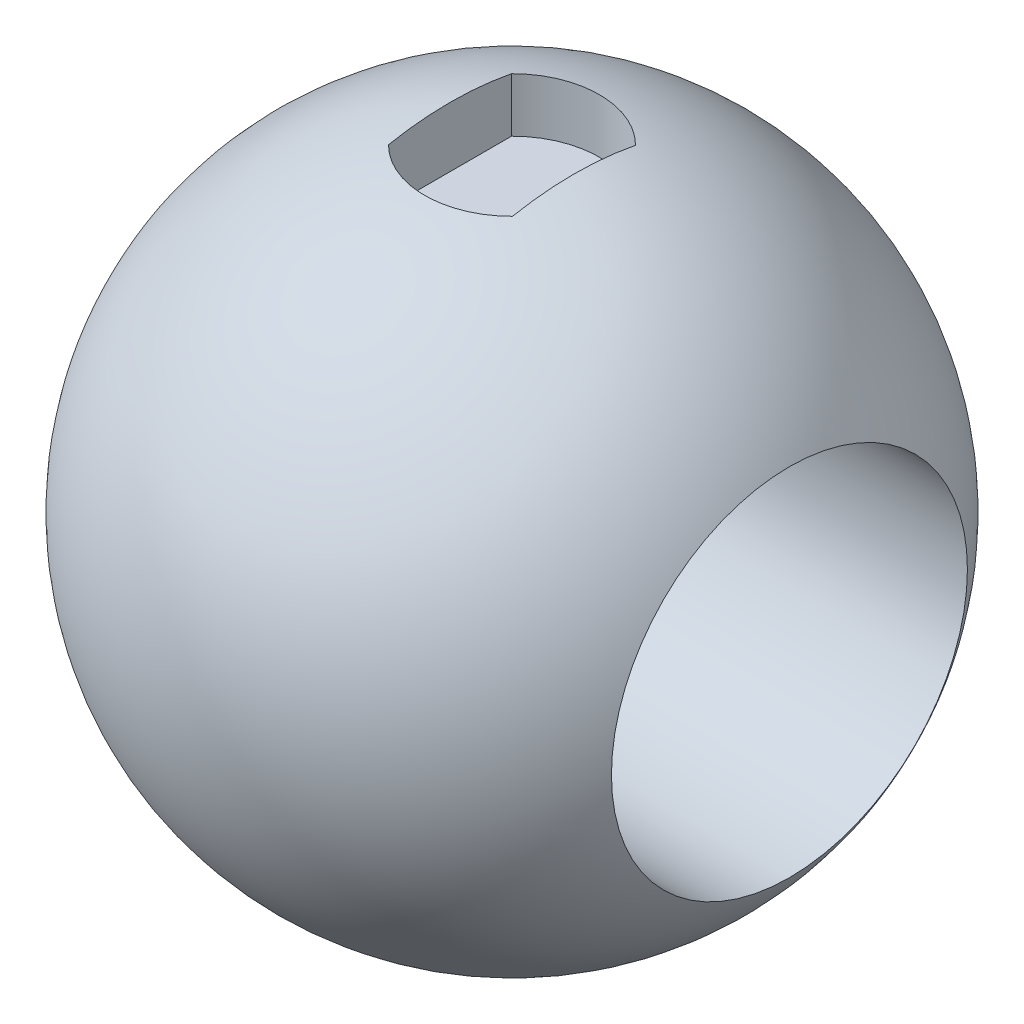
SolidWorks part; units mm, degrees
ref_plane "Front" through (0, 0, 0) normal (0, 0, 1) x (1, 0, 0)
ref_plane "Top" through (0, 0, 0) normal (0, 1, 0) x (1, 0, 0)
ref_plane "Right" through (0, 0, 0) normal (1, 0, 0) x (0, 0, -1)
sketch "Sketch1" plane through (0, 0, 0) normal (0, 0, 1) x (1, 0, 0)
  line L0 (-30, 0) -> (30, 0)
  arc A0 (-30, 0) -> (30, 0) centre (0, 0) cw
  point P2 (0, 0)
  dimension "D1" = 30
revolve "Revolve1" add sketch "Sketch1" angle 360 about L0
sketch "Sketch3" plane through (0, 0, 0) normal (0, 0, 1) x (1, 0, 0)
  line L1 (-25.25, 33.8038) -> (25.25, 33.8038)
  line L2 (-25.25, 33.8038) -> (-25.25, -33.8038)
  line L3 (-25.25, -33.8038) -> (25.25, -33.8038)
  line L4 (25.25, 33.8038) -> (25.25, -33.8038)
  line L5 (-25.25, 33.8038) -> (25.25, -33.8038) construction
  line L6 (-25.25, -33.8038) -> (25.25, 33.8038) construction
  point P4 (0, 0)
  dimension "D1" = 50.5
extrude "Cut-Extrude1" cut sketch "Sketch3" against normal through all both and the other way through all flip side to cut
sketch "Sketch4" plane through (25.25, 0, 0) normal (1, 0, 0) x (0, 0, -1)
  circle A0 centre (0, 0) radius 16.1999 construction
  circle A1 centre (0, 0) radius 16.1999
extrude "Cut-Extrude2" cut sketch "Sketch4" against normal through all
ref_plane "Plane1" through (0, 30, 0) normal (0, 1, 0) x (1, 0, 0)
sketch "Sketch5" plane through (0, 30, 0) normal (0, 1, 0) x (1, 0, 0)
  line L1 (-5.6429, -5.6) -> (-5.6429, 5.6)
  line L3 (5.6429, -5.6) -> (5.6429, 5.6)
  line L5 (-5.6429, -5.6) -> (5.6429, 5.6) construction
  line L6 (5.6429, -5.6) -> (-5.6429, 5.6) construction
  arc A0 (-5.6429, -5.6) -> (5.6429, -5.6) centre (0, 0) ccw
  arc A1 (-5.6429, 5.6) -> (5.6429, 5.6) centre (0, 0) cw
  point P0 (0, 0)
  dimension "D1" = 7.95
  dimension "D2" = 11.2
extrude "Cut-Extrude3" cut sketch "Sketch5" against normal blind 6
